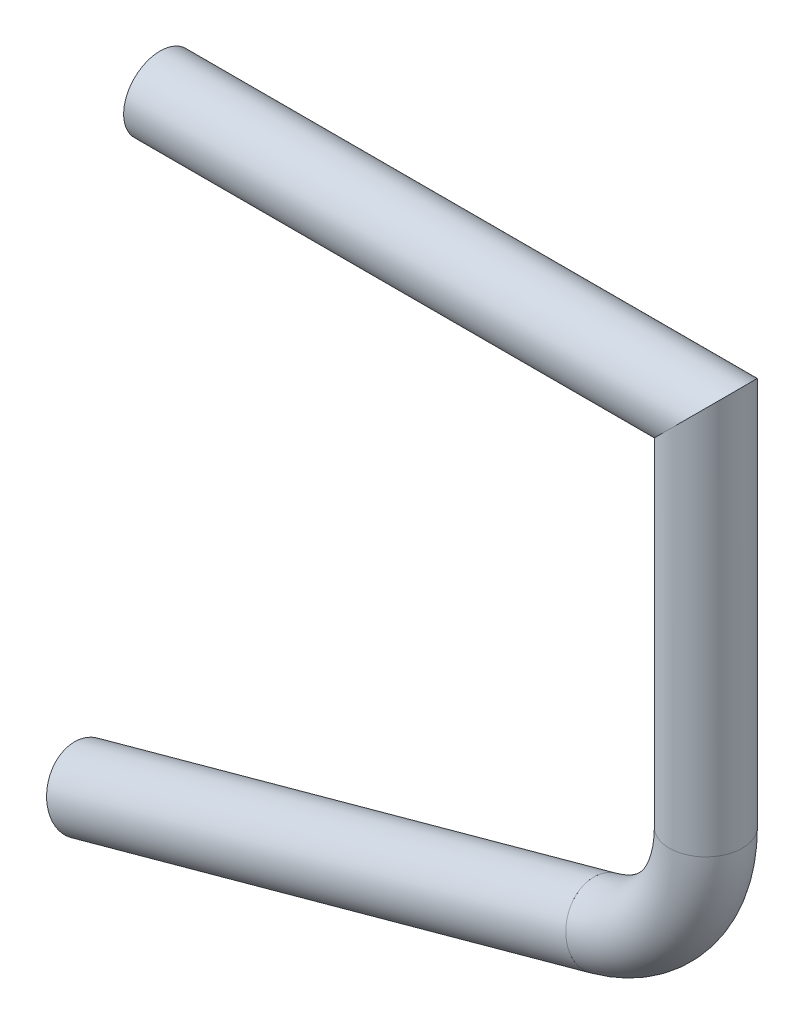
SolidWorks part; units mm, degrees
ref_plane "Ebene vorne" through (0, 0, 0) normal (0, 0, 1) x (1, 0, 0)
ref_plane "Ebene oben" through (0, 0, 0) normal (0, 1, 0) x (1, 0, 0)
ref_plane "Ebene rechts" through (0, 0, 0) normal (1, 0, 0) x (0, 0, -1)
sketch "Skizze1" plane through (0, 0, 0) normal (0, 0, 1) x (1, 0, 0)
  line L0 (0, 0) -> (317.5642, 0)
  line L1 (317.5642, 0) -> (317.5642, -211.1413)
  line L2 (257.9836, -289.2722) -> (-44.1129, -372.1628)
  arc A0 (317.5642, -211.1413) -> (257.9836, -289.2722) centre (236.5457, -211.1413) cw
other "Strukturbauteil1"
ref_plane "Ebene1" through (0, 0, 0) normal (1, 0, 0) x (0, 0, -1)
sketch "Skizze11" plane through (0, 0, 0) normal (1, 0, 0) x (0, 0, -1)
  line L0 (-21.2, -21.2) -> (21.2, 21.2) construction
  line L1 (-21.2, -21.2) -> (21.2, -21.2) construction
  line L2 (-21.2, -21.2) -> (-21.2, 21.2) construction
  line L3 (-21.2, 21.2) -> (21.2, 21.2) construction
  line L4 (21.2, -21.2) -> (21.2, 21.2) construction
  line L5 (-21.2, 0) -> (21.2, 0) construction
  line L6 (0, 21.2) -> (0, -21.2) construction
  circle A0 centre (0, 0) radius 21.2
  circle A1 centre (0, 0) radius 18.9
  point P11 (0, 0)
  dimension "D1" = 2.3
  dimension "D2" = 42.4
